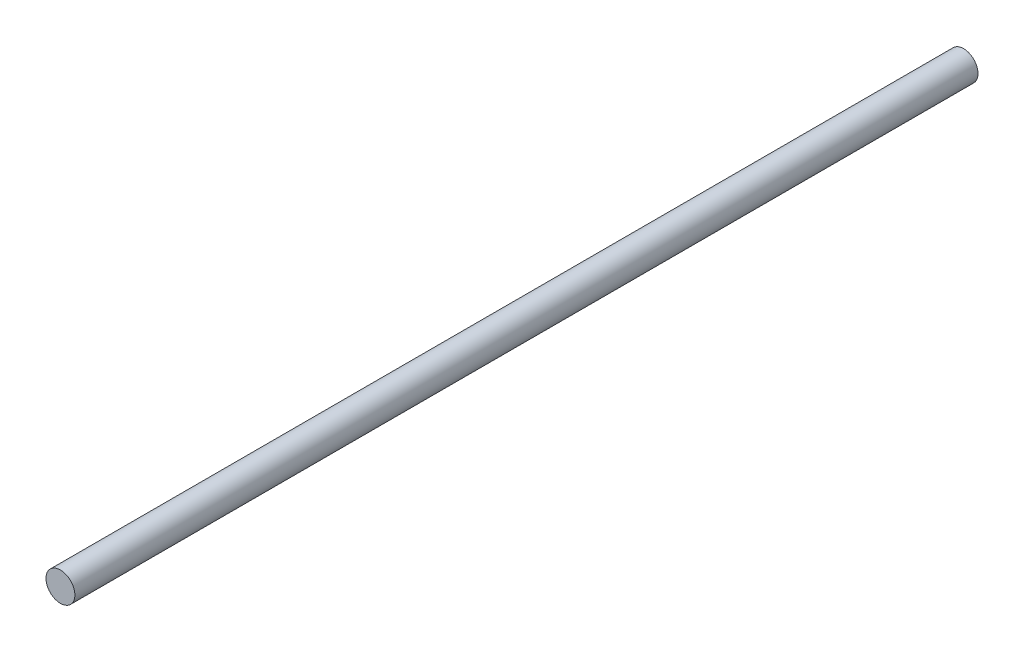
SolidWorks part; units mm, degrees
ref_plane "Alzado" through (0, 0, 0) normal (0, 0, 1) x (1, 0, 0)
ref_plane "Planta" through (0, 0, 0) normal (0, 1, 0) x (1, 0, 0)
ref_plane "Vista lateral" through (0, 0, 0) normal (1, 0, 0) x (0, 0, -1)
sketch "Sketch1" plane through (0, 0, 0) normal (0, 0, 1) x (1, 0, 0)
  circle A0 centre (0, 0) radius 4
  dimension "D1" = 8
extrude "Boss-Extrude1" add sketch "Sketch1" along normal mid plane 250
